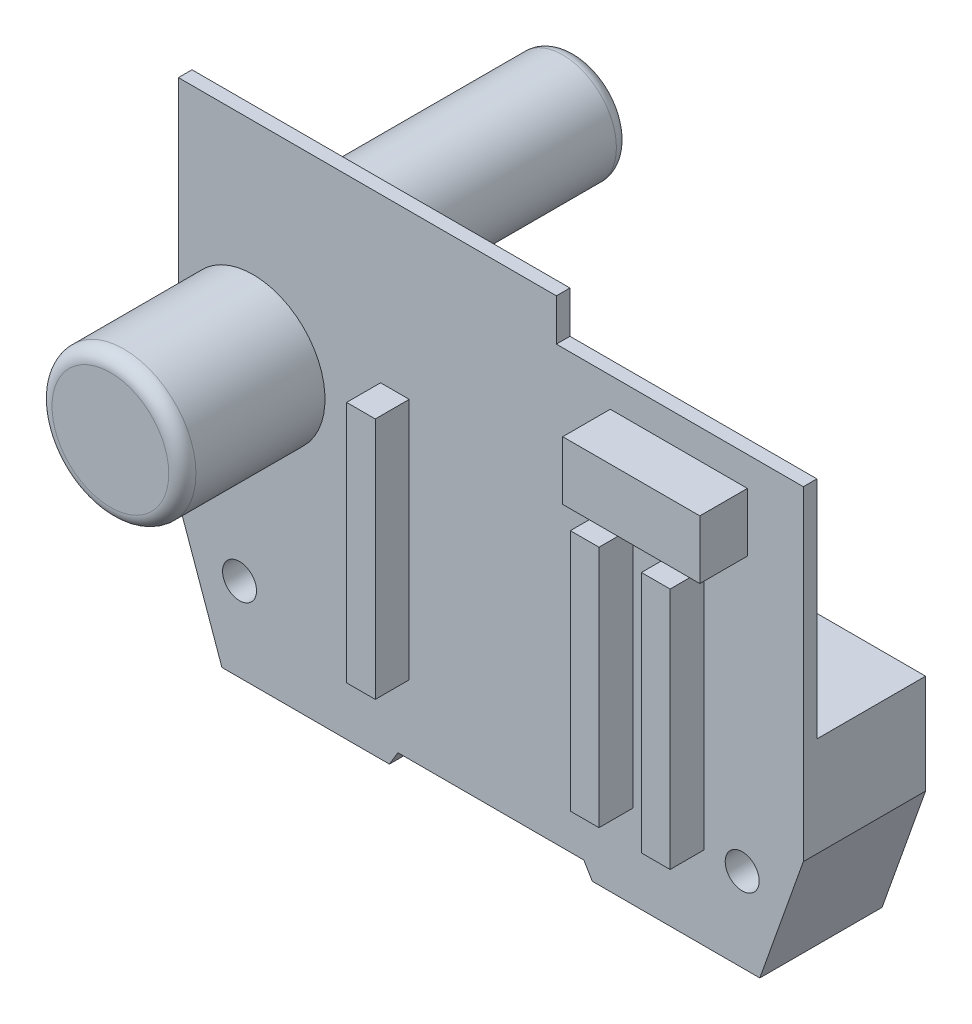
SolidWorks part; units mm, degrees
ref_plane "Face" through (0, 0, 0) normal (0, 0, 1) x (1, 0, 0)
ref_plane "Dessus" through (0, 0, 0) normal (0, 1, 0) x (1, 0, 0)
ref_plane "Droite" through (0, 0, 0) normal (1, 0, 0) x (0, 0, -1)
sketch "Esquisse1" plane through (0, 0, 0) normal (0, 0, 1) x (1, 0, 0)
  line L0 (-36.3564, 72) -> (-36.3564, 65.8422)
  line L1 (-92, 72) -> (-36.3564, 72)
  line L2 (-92, 72) -> (-92, 18.035)
  line L3 (-85.5949, 0) -> (-60.9345, 0)
  line L4 (0, 65.8422) -> (0, 18.035)
  line L5 (-36.3564, 65.8422) -> (0, 65.8422)
  line L6 (-92, 18.035) -> (-85.5949, 0)
  line L7 (-46, 86.74) -> (-46, -13.4547) construction
  line L8 (0, 18.035) -> (-6.4051, 0)
  line L9 (-60.9345, 0) -> (-59.6825, 2.0867)
  line L11 (-31.0655, 0) -> (-32.3175, 2.0867)
  line L12 (-31.0655, 0) -> (-6.4051, 0)
  line L13 (-59.6825, 2.0867) -> (-32.3175, 2.0867)
  circle A0 centre (-83, 12.3096) radius 2.5
  circle A1 centre (-9, 12.3096) radius 2.5
  dimension "D2" = 74
  dimension "D3" = 5
  dimension "D1" = 46
extrude "Extrusion1" add sketch "Esquisse1" along normal blind 2
sketch "Esquisse2" plane through (0, 0, 2) normal (0, 0, 1) x (1, 0, 0)
  circle A0 centre (-81.0116, 41.7957) radius 10.5932
extrude "Extrusion2" add sketch "Esquisse2" along normal blind 21
sketch "Esquisse3" plane through (0, 0, 2) normal (0, 0, 1) x (1, 0, 0)
  line L1 (-28.42, 61.5063) -> (-8.2351, 61.5063)
  line L2 (-28.42, 61.5063) -> (-28.42, 52.875)
  line L3 (-28.42, 52.875) -> (-8.2351, 52.875)
  line L4 (-8.2351, 61.5063) -> (-8.2351, 52.875)
extrude "Extrusion3" add sketch "Esquisse3" along normal blind 7
sketch "Esquisse4" plane through (0, 0, 2) normal (0, 0, 1) x (1, 0, 0)
  line L0 (-29.2991, 48.0878) -> (-25.0801, 48.0878)
  line L1 (-18.8329, 47.9888) -> (-14.6138, 47.9888)
  line L2 (-18.8329, 47.9888) -> (-18.8329, 12.2284)
  line L3 (-18.8329, 12.2284) -> (-14.6138, 12.2284)
  line L4 (-14.6138, 47.9888) -> (-14.6138, 12.2284)
  line L5 (-29.2991, 48.0878) -> (-29.2991, 12.3274)
  line L6 (-29.2991, 12.3274) -> (-25.0801, 12.3274)
  line L7 (-25.0801, 48.0878) -> (-25.0801, 12.3274)
  line L8 (-62.235, 47.9721) -> (-58.0159, 47.9721)
  line L9 (-62.235, 47.9721) -> (-62.235, 12.2117)
  line L10 (-62.235, 12.2117) -> (-58.0159, 12.2117)
  line L11 (-58.0159, 47.9721) -> (-58.0159, 12.2117)
extrude "Extrusion4" add sketch "Esquisse4" along normal blind 5
sketch "Esquisse5" plane through (0, 0, 0) normal (0, 0, -1) x (-1, 0, 0)
  line L0 (0, 32.6878) -> (92, 32.6878)
  line L8 (92, 18.035) -> (92, 72)
  line L9 (92, 72) -> (36.3564, 72)
  line L10 (36.3564, 72) -> (36.3564, 65.8422)
  line L11 (36.3564, 65.8422) -> (0, 65.8422)
  line L12 (0, 65.8422) -> (0, 18.035)
  line L13 (0, 18.035) -> (6.4051, 0)
  line L14 (60.9345, 0) -> (85.5949, 0)
  line L15 (85.5949, 0) -> (92, 18.035)
  line L16 (92, 18.035) -> (92, 32.6878)
  line L20 (0, 32.6878) -> (0, 18.035)
  line L21 (0, 18.035) -> (6.4051, 0)
  line L22 (60.9345, 0) -> (85.5949, 0)
  line L23 (85.5949, 0) -> (92, 18.035)
  line L26 (6.4051, 0) -> (31.0655, 0)
  line L27 (6.4051, 0) -> (31.0655, 0)
  line L28 (31.0655, 0) -> (32.3175, 2.0867)
  line L29 (31.0655, 0) -> (32.3175, 2.0867)
  line L30 (32.3175, 2.0867) -> (59.6825, 2.0867)
  line L31 (32.3175, 2.0867) -> (59.6825, 2.0867)
  line L32 (59.6825, 2.0867) -> (60.9345, 0)
  line L33 (59.6825, 2.0867) -> (60.9345, 0)
  dimension "D1" = 0
extrude "Extrusion5" add sketch "Esquisse5" along normal blind 16
sketch "Esquisse6" plane through (0, 0, 0) normal (0, 0, -1) x (-1, 0, 0)
  circle A0 centre (71.3972, 59.3113) radius 7.8799
extrude "Extrusion6" add sketch "Esquisse6" along normal blind 36
fillet "Congé1" radius 2
sketch "Esquisse7" plane through (0, 0, 0) normal (0, 0, 1) x (1, 0, 0)
  circle A0 centre (-83, 12.3096) radius 2.5 construction
  circle A1 centre (-9, 12.3096) radius 2.5 construction
  circle A2 centre (-83, 12.3096) radius 2.5
  circle A3 centre (-9, 12.3096) radius 2.5
extrude "Enlèv. mat.-Extru.1" cut sketch "Esquisse7" against normal through all
